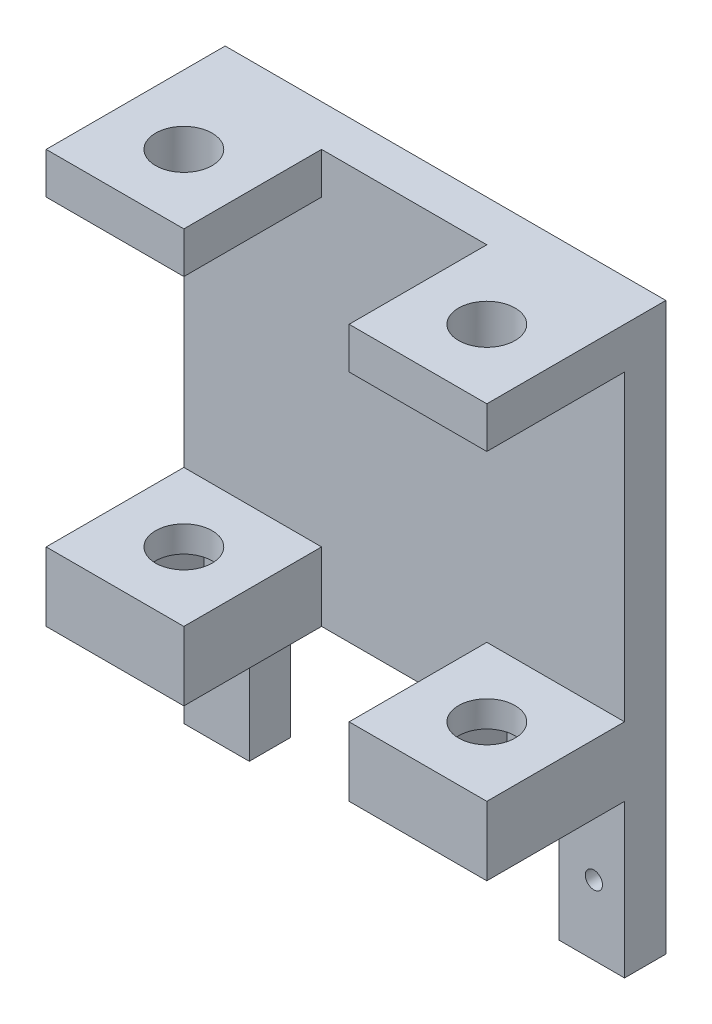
SolidWorks part; units mm, degrees
ref_plane "Alzado" through (0, 0, 0) normal (0, 0, 1) x (1, 0, 0)
ref_plane "Planta" through (0, 0, 0) normal (0, 1, 0) x (1, 0, 0)
ref_plane "Vista lateral" through (0, 0, 0) normal (1, 0, 0) x (0, 0, -1)
sketch "Sketch1" plane through (0, 0, 0) normal (0, 0, 1) x (1, 0, 0)
  line L5 (-2.5, -9.5) -> (2.5, -9.5) construction
  line L6 (-2.5, -9.5) -> (-2.5, 9.5) construction
  line L7 (-2.5, 9.5) -> (2.5, 9.5) construction
  line L8 (2.5, -9.5) -> (2.5, 9.5) construction
  line L9 (-2.5, -9.5) -> (2.5, 9.5) construction
  line L10 (-2.5, 9.5) -> (2.5, -9.5) construction
  circle A0 centre (0, 0) radius 1.15
  circle A1 centre (2.5, 9.5) radius 1.15
  circle A2 centre (-2.5, 9.5) radius 1.15
  circle A3 centre (-2.5, -9.5) radius 1.15
  circle A4 centre (2.5, -9.5) radius 1.15
  dimension "D1" = 2.3
  dimension "D2" = 19
  dimension "D3" = 5
  dimension "D4" = 0
  dimension "D5" = 5
extrude "Boss-Extrude1" add sketch "Sketch1" along normal blind 2.5
sketch "Sketch2" plane through (0, 0, 2.5) normal (0, 0, 1) x (1, 0, 0)
  line L1 (-16, 15) -> (16, 15)
  line L2 (-16, 15) -> (-16, -15)
  line L3 (-16, -15) -> (16, -15)
  line L4 (16, 15) -> (16, -15)
  line L5 (-16, 15) -> (16, -15) construction
  line L6 (-16, -15) -> (16, 15) construction
  point P0 (0, 0)
  dimension "D1" = 30
  dimension "D2" = 32
extrude "Boss-Extrude2" add sketch "Sketch2" along normal blind 3
sketch "Sketch3" plane through (0, 0, 5.5) normal (0, 0, 1) x (1, 0, 0)
  line L0 (16, -15) -> (16, 15) construction
  line L1 (-16, 15) -> (16, 15)
  line L2 (-16, 15) -> (-16, 12)
  line L3 (-16, 12) -> (16, 12)
  line L4 (16, 15) -> (16, 12)
  line L5 (-16, 15) -> (16, 12) construction
  line L6 (-16, 12) -> (16, 15) construction
  line L8 (-16, -15) -> (16, -15)
  line L9 (-16, -15) -> (-16, -10)
  line L10 (-16, -10) -> (16, -10)
  line L11 (16, -15) -> (16, -10)
  line L12 (-16, -15) -> (16, -10) construction
  line L13 (-16, -10) -> (16, -15) construction
  line L14 (-6, 15) -> (6, 15)
  line L15 (-6, 15) -> (-6, 12)
  line L16 (-6, 12) -> (6, 12)
  line L17 (6, 15) -> (6, 12)
  line L18 (-6, 15) -> (6, 12) construction
  line L19 (-6, 12) -> (6, 15) construction
  line L20 (-6, -10) -> (6, -10)
  line L21 (-6, -10) -> (-6, -15)
  line L22 (-6, -15) -> (6, -15)
  line L23 (6, -10) -> (6, -15)
  line L24 (-6, -10) -> (6, -15) construction
  line L25 (-6, -15) -> (6, -10) construction
  point P4 (0, 13.5)
  point P12 (0, -12.5)
  point P13 (0, 13.5)
  point P19 (0, -12.5)
  point P24 (16, 13.5)
  dimension "D1" = 3
  dimension "D2" = 5
  dimension "D3" = 10
extrude "Boss-Extrude3" add sketch "Sketch3" along normal blind 10 contours L15 L3 M4 M5 | L17 L3 M4 M3 | L10 L23 M6 M3 | L21 L10 M5 M6
sketch "Sketch4" plane through (0, 15, 0) normal (0, 1, 0) x (1, 0, 0)
  line L0 (-16, -15.5) -> (-16, -2.5) construction
  line L1 (16, -15.5) -> (16, -2.5) construction
  line L3 (-6, -15.5) -> (-16, -15.5) construction
  circle A0 centre (11, -10.5) radius 2.05
  circle A1 centre (-11, -10.5) radius 2.05
  dimension "D1" = 5
  dimension "D4" = 4.1
  dimension "D2" = 5
  dimension "D3" = 5
extrude "Cut-Extrude1" cut sketch "Sketch4" against normal through all
sketch "Sketch6" plane through (0, -15, 0) normal (0, -1, 0) x (1, 0, 0)
  line L1 (-8.9793, 7) -> (-6.9585, 10.5)
  line L2 (-6.9585, 10.5) -> (-8.9793, 14)
  line L3 (-8.9793, 14) -> (-13.0207, 14)
  line L4 (-13.0207, 14) -> (-15.0415, 10.5)
  line L5 (-15.0415, 10.5) -> (-13.0207, 7)
  line L6 (-13.0207, 7) -> (-8.9793, 7)
  line L7 (13.0207, 7) -> (15.0415, 10.5)
  line L8 (15.0415, 10.5) -> (13.0207, 14)
  line L9 (13.0207, 14) -> (8.9793, 14)
  line L10 (8.9793, 14) -> (6.9585, 10.5)
  line L11 (6.9585, 10.5) -> (8.9793, 7)
  line L12 (8.9793, 7) -> (13.0207, 7)
  circle A0 centre (-11, 10.5) radius 3.5 construction
  circle A1 centre (11, 10.5) radius 3.5 construction
  dimension "D1" = 7
  dimension "D2" = 7
extrude "Cut-Extrude2" cut sketch "Sketch6" against normal blind 3.1
sketch "Sketch7" plane through (0, 0, 5.5) normal (0, 0, 1) x (1, 0, 0)
  line L1 (-16, -15) -> (-11.25, -15)
  line L2 (-16, -15) -> (-16, -26.11)
  line L3 (-16, -26.11) -> (-11.25, -26.11)
  line L4 (-11.25, -15) -> (-11.25, -26.11)
  line L5 (-16, -15) -> (-11.25, -26.11) construction
  line L6 (-16, -26.11) -> (-11.25, -15) construction
  line L7 (16, -15) -> (11.25, -15)
  line L8 (16, -15) -> (16, -26.11)
  line L9 (16, -26.11) -> (11.25, -26.11)
  line L10 (11.25, -15) -> (11.25, -26.11)
  line L11 (16, -15) -> (11.25, -26.11) construction
  line L12 (16, -26.11) -> (11.25, -15) construction
  circle A2 centre (-13.775, -21.055) radius 0.625
  circle A3 centre (13.775, -21.055) radius 0.625
  point P4 (-13.625, -20.555)
  point P10 (13.625, -20.555)
  point P14 (13.625, -20.7712)
  point P17 (-13.5499, -20.555)
  point P18 (-13.5462, -20.555)
  point P19 (-13.625, -20.6413)
  point P20 (0, 0)
  point P21 (13.625, -21.7912)
  point P22 (0, 0)
  point P23 (-13.7372, -21.055)
  point P24 (0, 0)
  point P25 (13.7302, -21.055)
  point P26 (-13.625, -20.555)
  dimension "D3" = 1.25
  dimension "D5" = 0.5
  dimension "D1" = 11.11
  dimension "D2" = 4.75
  dimension "D4" = 0.5
  dimension "D6" = 0.15
  dimension "D7" = 0.15
extrude "Boss-Extrude4" add sketch "Sketch7" against normal up to surface (3 mm away)
